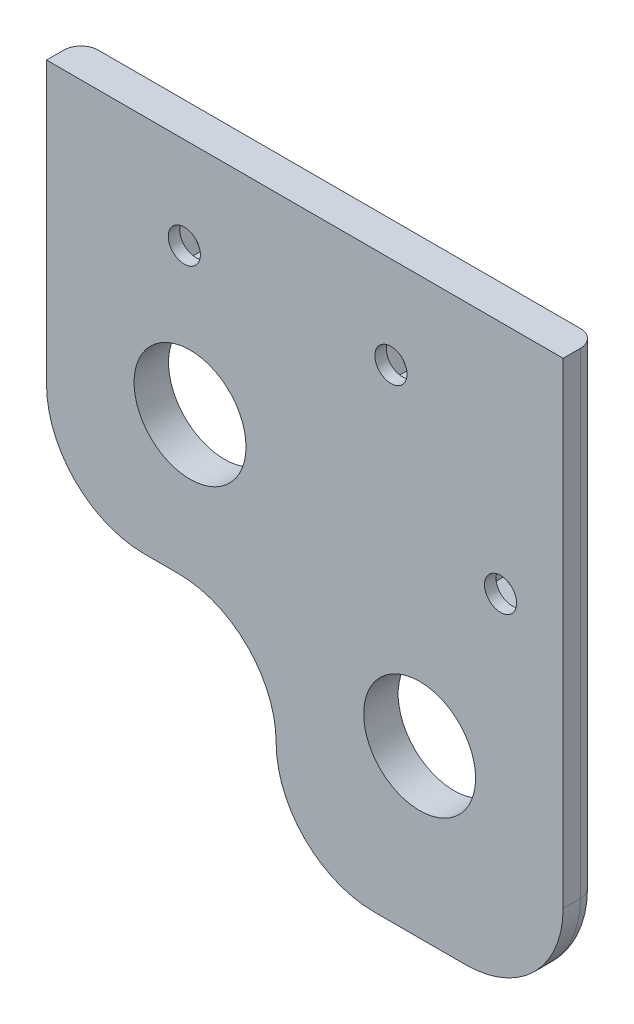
SolidWorks part; units mm, degrees
ref_plane "Front Plane" through (0, 0, 0) normal (0, 0, 1) x (1, 0, 0)
ref_plane "Top Plane" through (0, 0, 0) normal (0, 1, 0) x (1, 0, 0)
ref_plane "Right Plane" through (0, 0, 0) normal (1, 0, 0) x (0, 0, -1)
sketch "Sketch1" plane through (0, 0, 0) normal (0, 0, 1) x (1, 0, 0)
  line L0 (45, 12) -> (12.5, 12) construction
  line L3 (0, 32.5) -> (45, 32.5)
  line L5 (45, -17.5) -> (0, -17.5)
  line L6 (45, 32.5) -> (45, -17.5)
  line L14 (12.5, 12) -> (12.5, -3) construction
  line L15 (12.5, -3) -> (32.5, -3) construction
  line L16 (0, 32.5) -> (0, -17.5)
  circle A0 centre (12.5, 12) radius 4.875
  circle A1 centre (32.5, -3) radius 4.875
  dimension "D4" = 9.75
  dimension "D7" = 15
  dimension "D5" = 20.5
  dimension "D1" = 17.5
  dimension "D2" = 12.5
  dimension "D3" = 50
  dimension "D6" = 12.5
  dimension "D8" = 12.5
  dimension "D9" = 20
extrude "Boss-Extrude1" add sketch "Sketch1" along normal blind 3
sketch "Sketch4" plane through (0, 0, 3) normal (0, 0, 1) x (1, 0, 0)
  line L0 (12.5, 12) -> (0, 12) construction
  line L1 (0, -17.5) -> (20, -17.5)
  line L2 (0, -17.5) -> (0, -0.5)
  line L3 (0, -0.5) -> (20, -0.5)
  line L4 (20, -17.5) -> (20, -0.5)
  line L5 (0, 32.5) -> (0, -17.5) construction
  line L6 (32.5, -3) -> (32.5, -17.5) construction
  line L7 (0, -17.5) -> (45, -17.5) construction
  dimension "D1" = 12.5
  dimension "D2" = 12.5
extrude "Cut-Extrude1" cut sketch "Sketch4" against normal up to next
fillet "Fillet3" radius 8.5 4 edges at (20, -0.5, 1.5) (45, -17.5, 1.5) (0, -0.5, 1.5) (20, -17.5, 1.5)
fillet "Fillet4" radius 1.5 8 edges at (45, 11.75, 0) (42.5104, -15.0104, 0) (32.5, -17.5, 0) (22.4896, -15.0104, 0) (0, 20.25, 0) (2.4896, 1.9896, 0) (10, -0.5, 0) (17.5104, -2.9896, 0)
sketch "Sketch5" plane through (0, 0, 0) normal (0, 0, -1) x (-1, 0, 0)
  line L0 (-43.5, 24.5) -> (-1.5, 24.5) construction
  line L1 (-43.5, 32.5) -> (-43.5, -9) construction
  line L2 (-1.5, 8) -> (-1.5, 32.5) construction
  line L3 (-45, -9) -> (-45, 32.5) construction
  line L4 (0, 32.5) -> (0, 8) construction
  line L5 (-45, 32.5) -> (0, 32.5) construction
  circle A0 centre (-30, 24.5) radius 1.4
  circle A1 centre (-12, 24.5) radius 1.4
  circle A2 centre (-39.55, 12) radius 1.4
  dimension "D1" = 2.8
  dimension "D2" = 15
  dimension "D3" = 12
  dimension "D4" = 8
  dimension "D5" = 20.5
  dimension "D6" = 5.45
extrude "Cut-Extrude2" cut sketch "Sketch5" against normal up to next
sketch "Sketch6" plane through (0, 0, 0) normal (0, 0, -1) x (-1, 0, 0)
  line L0 (-43.5, 32.5) -> (-43.5, -9) construction
  line L1 (-36.825, 13.5733) -> (-39.55, 15.1466)
  line L2 (-39.55, 15.1466) -> (-42.275, 13.5733)
  line L3 (-42.275, 13.5733) -> (-42.275, 10.4267)
  line L4 (-42.275, 10.4267) -> (-39.55, 8.8534)
  line L5 (-39.55, 8.8534) -> (-36.825, 10.4267)
  line L6 (-36.825, 10.4267) -> (-36.825, 13.5733)
  line L7 (-26.8534, 24.5) -> (-28.4267, 27.225)
  line L8 (-28.4267, 27.225) -> (-31.5733, 27.225)
  line L9 (-31.5733, 27.225) -> (-33.1466, 24.5)
  line L10 (-33.1466, 24.5) -> (-31.5733, 21.775)
  line L11 (-31.5733, 21.775) -> (-28.4267, 21.775)
  line L12 (-28.4267, 21.775) -> (-26.8534, 24.5)
  line L13 (-8.8534, 24.5) -> (-10.4267, 27.225)
  line L14 (-10.4267, 27.225) -> (-13.5733, 27.225)
  line L15 (-13.5733, 27.225) -> (-15.1466, 24.5)
  line L16 (-15.1466, 24.5) -> (-13.5733, 21.775)
  line L17 (-13.5733, 21.775) -> (-10.4267, 21.775)
  line L18 (-10.4267, 21.775) -> (-8.8534, 24.5)
  line L19 (-43.5, 32.5) -> (-1.5, 32.5) construction
  circle A0 centre (-39.55, 12) radius 2.725 construction
  circle A1 centre (-30, 24.5) radius 2.725 construction
  circle A2 centre (-12, 24.5) radius 2.725 construction
  dimension "D1" = 5.45
extrude "Cut-Extrude3" cut sketch "Sketch6" against normal blind 2
